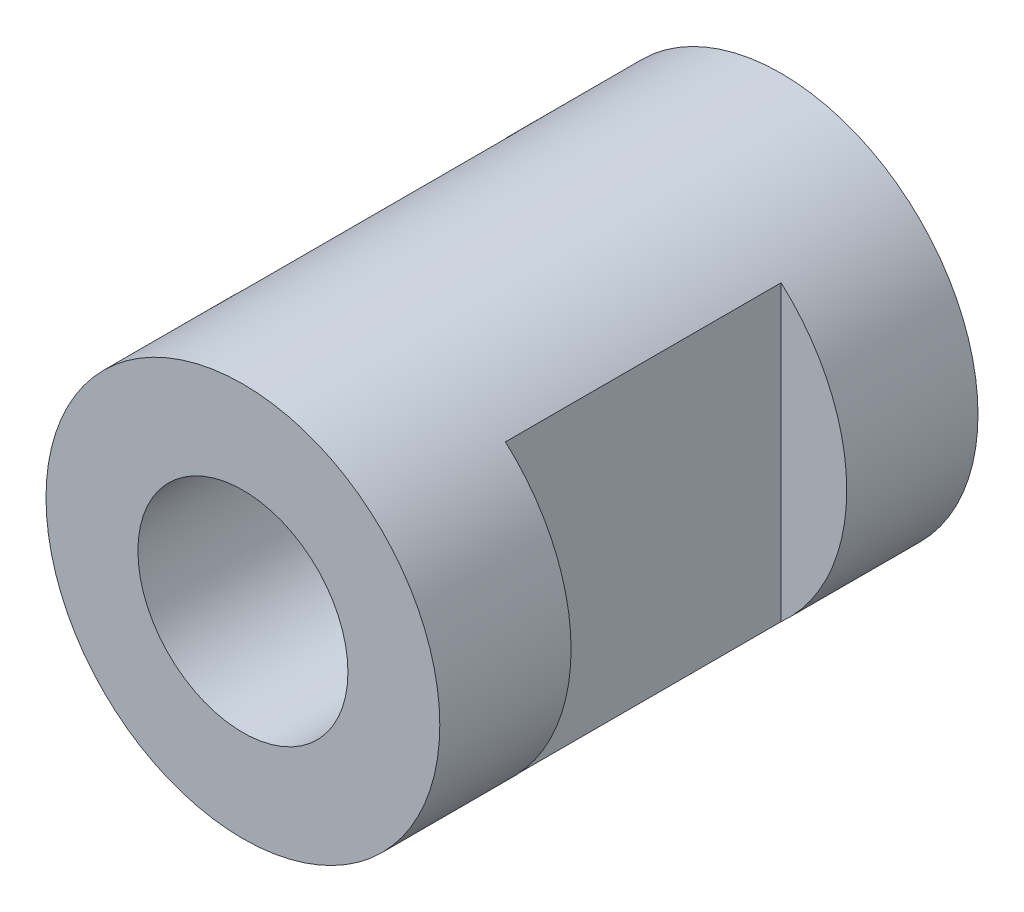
SolidWorks part; units mm, degrees
ref_plane "前视基准面" through (0, 0, 0) normal (0, 0, 1) x (1, 0, 0)
ref_plane "上视基准面" through (0, 0, 0) normal (0, 1, 0) x (1, 0, 0)
ref_plane "右视基准面" through (0, 0, 0) normal (1, 0, 0) x (0, 0, -1)
sketch "草图1" plane through (0, 0, 0) normal (0, 0, 1) x (1, 0, 0)
  circle A0 centre (0, 0) radius 7.5
extrude "凸台-拉伸1" add sketch "草图1" along normal blind 20.5
ref_plane "基准面1" through (0, 10, 0) normal (0, 1, 0) x (-1, 0, 0)
sketch "草图2" plane through (0, 10, 0) normal (0, 1, 0) x (-1, 0, 0)
  line L0 (-7.5, 20.5) -> (-7.5, 0) construction
  line L1 (-9.6357, 15.5) -> (-5, 15.5)
  line L2 (-9.6357, 15.5) -> (-9.6357, 5)
  line L3 (-9.6357, 5) -> (-5, 5)
  line L4 (-5, 15.5) -> (-5, 5)
  line L5 (0, 20.5) -> (0, 0) construction
  line L6 (7.5, 20.5) -> (-7.5, 20.5) construction
  line L7 (0, 10.25) -> (7.4774, 10.25) construction
  line L10 (9.6357, 5) -> (5, 5)
  line L11 (9.6357, 15.5) -> (9.6357, 5)
  line L12 (5, 15.5) -> (5, 5)
  line L13 (9.6357, 15.5) -> (5, 15.5)
  dimension "D1" = 2.5
  dimension "D2" = 10.5
extrude "切除-拉伸1" cut sketch "草图2" against normal blind 20.5
sketch "草图3" plane through (0, 0, 0) normal (0, 0, -1) x (-1, 0, 0)
  circle A0 centre (0, 0) radius 4
extrude "切除-拉伸2" cut sketch "草图3" against normal blind 20.5
